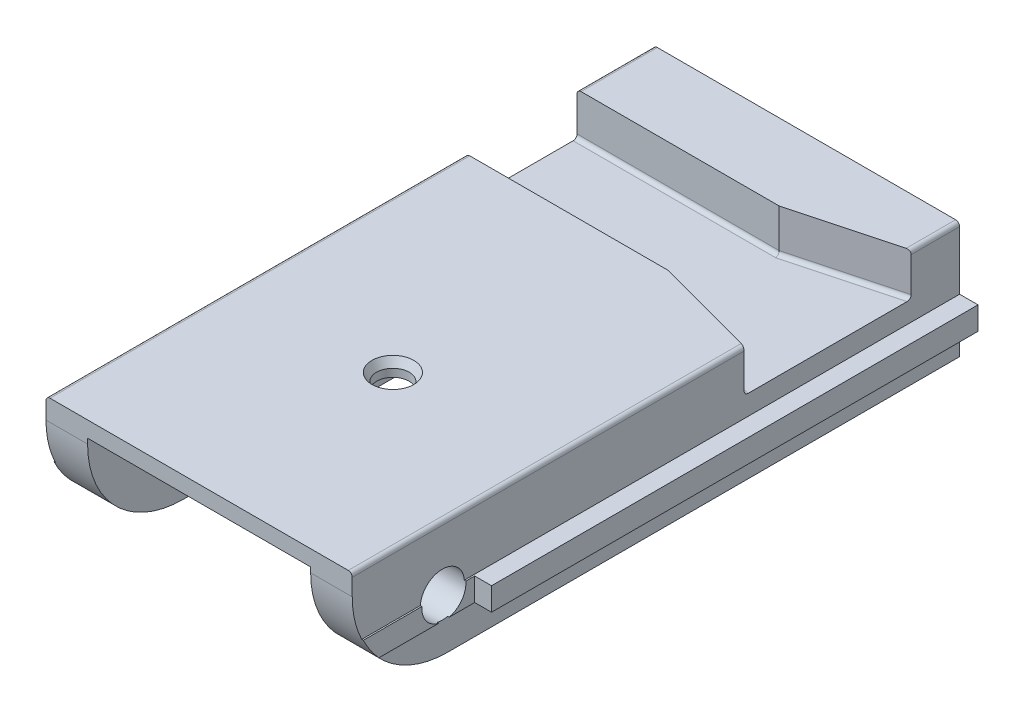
SolidWorks part; units mm, degrees
ref_plane "Спереди" through (0, 0, 0) normal (0, 0, 1) x (1, 0, 0)
ref_plane "Сверху" through (0, 0, 0) normal (0, 1, 0) x (1, 0, 0)
ref_plane "Справа" through (0, 0, 0) normal (1, 0, 0) x (0, 0, -1)
sketch "Эскиз1" plane through (0, 0, 0) normal (0, 0, 1) x (1, 0, 0)
  line L0 (0, 0) -> (0, 27.7709) construction
  line L1 (-15.24, 5.3848) -> (-15.24, 11.2109)
  line L2 (15.24, 0) -> (-15.24, 0)
  line L3 (15.24, 0) -> (15.24, 3.0988)
  line L4 (14.8431, 11.6078) -> (-14.8431, 11.6078)
  line L5 (-15.24, 0) -> (-15.24, 3.0988)
  line L6 (17.0688, 3.0988) -> (15.24, 3.0988)
  line L7 (17.0688, 3.0988) -> (17.0688, 5.3848)
  line L8 (17.0688, 5.3848) -> (15.24, 5.3848)
  line L9 (-17.0688, 3.0988) -> (-17.0688, 5.3848)
  line L10 (15.24, 5.3848) -> (15.24, 11.2109)
  line L11 (-15.24, 5.3848) -> (-17.0688, 5.3848)
  line L12 (-15.24, 3.0988) -> (-17.0688, 3.0988)
  arc A0 (-14.8431, 11.6078) -> (-15.24, 11.2109) centre (-14.8431, 11.2109) ccw
  arc A1 (15.24, 11.2109) -> (14.8431, 11.6078) centre (14.8431, 11.2109) ccw
  dimension "D6" = 0.3969
  dimension "D1" = 30.48
  dimension "D2" = 34.1376
  dimension "D3" = 6.223
  dimension "D4" = 2.286
  dimension "D5" = 11.6078
extrude "Бобышка-Вытянуть1" add sketch "Эскиз1" along normal blind 60.452
sketch "Эскиз2" plane through (0, 0, 0) normal (1, 0, 0) x (0, 0, -1)
  line L0 (-20.32, 6.477) -> (0, 6.477)
  line L1 (0, 6.477) -> (0, 0)
  line L2 (0, 0) -> (-60.452, 0)
  line L3 (-60.452, 0) -> (-60.452, 10.033)
  line L4 (-60.452, 10.033) -> (-37.7408, 10.033)
  line L5 (-60.452, 5.3848) -> (-60.452, 11.2109) construction
  line L6 (-60.452, 11.6078) -> (0, 11.6078) construction
  arc A0 (-37.7408, 10.033) -> (-20.32, 6.477) centre (-37.7408, -34.417) cw
  dimension "D3" = 44.45
  dimension "D1" = 1.5748
  dimension "D2" = 5.1308
  dimension "D4" = 20.32
extrude "Вырез-Вытянуть1" cut sketch "Эскиз2" against normal mid plane 22.1996
sketch "Эскиз3" plane through (0, 11.6078, 0) normal (0, 1, 0) x (1, 0, 0)
  line L0 (-24.2176, -13.1318) -> (25.5103, -13.1318) construction
  line L1 (-15.24, -18.669) -> (-15.24, -7.5946)
  line L2 (-15.24, -7.5946) -> (4.8719, -7.5946)
  line L3 (4.8719, -7.5946) -> (15.24, -4.8165)
  line L4 (15.24, -4.8165) -> (15.24, -21.4471)
  line L5 (15.24, -21.4471) -> (4.8719, -18.669)
  line L6 (4.8719, -18.669) -> (-15.24, -18.669)
  line L8 (-15.24, -60.452) -> (-15.24, 0) construction
  line L9 (15.24, -60.452) -> (15.24, 0) construction
  line L10 (14.8431, 0) -> (-14.8431, 0) construction
  dimension "D1" = 15
  dimension "D2" = 7.5946
  dimension "D3" = 11.0744
  dimension "D4" = 2.7781
extrude "Вырез-Вытянуть2" cut sketch "Эскиз3" against normal offset from surface (4.2418 mm away) 7.366
sketch "Эскиз4" plane through (0, 11.6078, 0) normal (0, 1, 0) x (1, 0, 0)
  line L0 (14.8431, -60.452) -> (-14.8431, -60.452) construction
  line L1 (-17.0688, -48.4187) -> (-15.3924, -48.4187)
  line L2 (-17.0688, -48.4187) -> (-17.0688, -60.452)
  line L3 (-17.0688, -60.452) -> (-15.3924, -60.452)
  line L4 (-15.3924, -48.4187) -> (-15.3924, -60.452)
  line L5 (15.3924, -48.4187) -> (17.0688, -48.4187)
  line L6 (15.3924, -48.4187) -> (15.3924, -60.452)
  line L7 (15.3924, -60.452) -> (17.0688, -60.452)
  line L8 (17.0688, -48.4187) -> (17.0688, -60.452)
  line L9 (-17.0688, -60.452) -> (-17.0688, 0) construction
  line L10 (17.0688, -60.452) -> (17.0688, 0) construction
  line L13 (14.8431, 0) -> (-14.8431, 0) construction
  line L14 (4.8719, -7.5946) -> (-14.8431, -7.5946) construction
  line L15 (15.24, -60.452) -> (15.24, 0) construction
  line L16 (-15.24, -60.452) -> (-15.24, 0) construction
  circle A0 centre (0, -41.167) radius 1.6256
  dimension "D3" = 3.2512
  dimension "D1" = 48.4187
  dimension "D2" = 33.5724
  dimension "D4" = 0.1524
  dimension "D5" = 0.1524
extrude "Вырез-Вытянуть3" cut sketch "Эскиз4" against normal through all
sketch "Эскиз5" plane through (17.0688, 0, 0) normal (1, 0, 0) x (0, 0, -1)
  line L0 (-60.452, 9.525) -> (-60.452, 0)
  line L1 (-60.452, 0) -> (-50.927, 0)
  line L2 (-60.452, 5.3848) -> (-60.452, 11.2109) construction
  line L3 (-7.5946, 7.366) -> (-7.5946, 11.6078) construction
  line L4 (-60.452, 11.6078) -> (-21.3408, 11.6078) construction
  circle A0 centre (-51.4858, 5.2324) radius 2.1971
  arc A1 (-50.927, 0) -> (-60.452, 9.525) centre (-50.927, 9.525) cw
  dimension "D1" = 4.3942
  dimension "D2" = 9.525
  dimension "D3" = 43.8912
  dimension "D4" = 6.3754
extrude "Вырез-Вытянуть4" cut sketch "Эскиз5" against normal through all
sketch "Эскиз6" plane through (11.0998, 0, 0) normal (-1, 0, 0) x (0, 0, 1)
  line L0 (50.927, 0) -> (0, 0) construction
  line L2 (6.8263, 0) -> (48.1715, 0)
  arc A0 (48.1715, 0) -> (20.32, 6.477) centre (30.3915, -13.335) ccw
  arc A1 (20.32, 6.477) -> (6.8263, 0) centre (22.6289, -15.6277) ccw
  point P8 (30.3915, 8.89)
  dimension "D3" = 22.225
  dimension "D4" = 22.225
  dimension "D1" = 13.4937
  dimension "D2" = 8.89
extrude "Вырез-Вытянуть5" cut sketch "Эскиз6" against normal blind 3.175
chamfer "Фаска1" distance 0.7937 angle 30 1 edges at (0, 11.6078, 42.7926)
fillet "Скругление1" radius 0.3969 6 edges at (11.0998, 6.477, 10.16) (-11.0998, 6.477, 10.16) (10.0559, 7.366, 6.2055) (-5.1841, 7.366, 7.5946) (10.0559, 7.366, 20.0581) (-5.1841, 7.366, 18.669)
equation "\"D2@Эскиз4\"=1.728-13/32"
